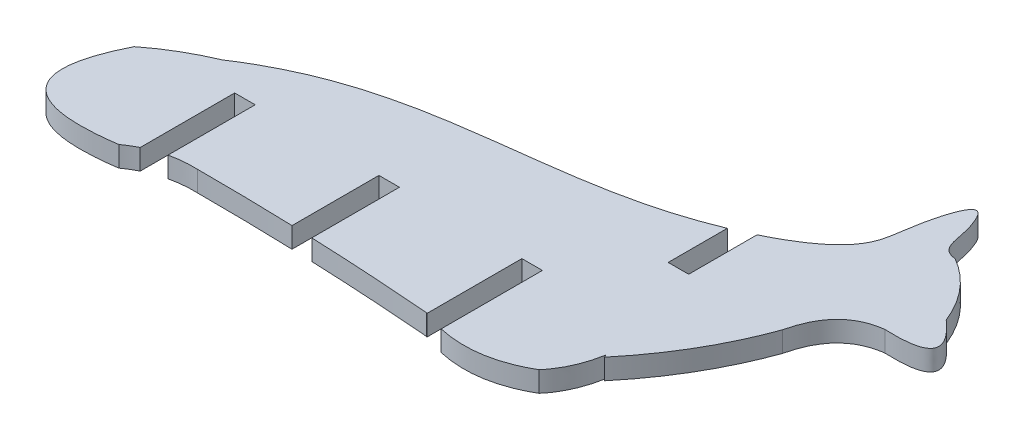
SolidWorks part; units mm, degrees
ref_plane "Alzado" through (0, 0, 0) normal (0, 0, 1) x (1, 0, 0)
ref_plane "Planta" through (0, 0, 0) normal (0, 1, 0) x (1, 0, 0)
ref_plane "Vista lateral" through (0, 0, 0) normal (1, 0, 0) x (0, 0, -1)
sketch "Croquis2" plane through (0, 0, 0) normal (0, 1, 0) x (1, 0, 0)
  line L0 (-20.4658, 19.6564) -> (39.7066, 19.6564) construction
  line L1 (55.0566, 13.5654) -> (55.2406, 13.232)
  line L19 (-5.2934, 19.6437) -> (-2.2934, 19.6437)
  line L20 (-5.2934, 19.6437) -> (-5.2934, 5.8226)
  line L22 (-2.2934, 19.6437) -> (-2.2934, 6.8949)
  line L24 (15.7066, 19.7494) -> (18.7066, 19.7494)
  line L25 (15.7066, 19.7494) -> (15.7066, 7.0318)
  line L27 (18.7066, 19.7494) -> (18.7066, 6.9231)
  line L28 (36.7066, 19.6674) -> (39.7066, 19.6674)
  line L29 (36.7066, 19.6674) -> (36.7066, 5.7706)
  line L31 (39.7066, 19.6674) -> (39.7066, 4.85)
  line L32 (50.8938, 39.8804) -> (50.8938, 29.8804)
  line L33 (50.8938, 29.8804) -> (47.8938, 29.8804)
  line L34 (47.8938, 38.5314) -> (47.8938, 29.8804)
  spline S0 degree 3 poles (47.8938, 38.5314) (28.0082, 30.2806) (8.6356, 35.4977) (-10.3742, 22.9361) knots 0.375874 0.375874 0.375874 0.375874 1 1 1 1
  spline S3 degree 3 poles (-5.2934, 5.8226) (-5.9644, 5.4879) (-6.6112, 5.0949) (-7.2337, 4.6437) knots 0.757247 0.757247 0.757247 0.757247 1 1 1 1
  spline S4 degree 3 poles (36.5574, 5.8293) (30.6107, 6.3212) (24.6604, 6.6858) (18.7066, 6.9231) knots 0.259121 0.259121 0.259121 0.259121 0.638689 0.638689 0.638689 0.638689
  spline S6 degree 2 poles (1.6945, 7.2544) (-0.4049, 7.3278) (-2.2934, 6.8949) knots 0 0 0 0.413123 0.413123 0.413123
  spline S7 degree 2 poles (-18.5169, 18.1508) (-26.7523, 1.7708) (-7.2337, 4.6437) knots 0 0 0 1 1 1
  spline S8 degree 2 poles (36.5574, 5.8293) (36.632, 5.7996) (36.7066, 5.7706) knots 0 0 0 0.009141 0.009141 0.009141
  spline S9 degree 3 poles (-18.5169, 18.1508) (-16.0294, 20.1252) (-13.2797, 21.6905) (-10.3742, 22.9361) knots 0.333246 0.333246 0.333246 0.333246 0.571138 0.571138 0.571138 0.571138
  spline S12 degree 2 poles (55.0566, 13.5654) (54.3373, 9.5112) (52.0237, 6.8354) knots 0 0 0 0.509779 0.509779 0.509779
  spline S13 degree 3 poles (15.7066, 7.0318) (11.0381, 7.1843) (6.3674, 7.2585) (1.6945, 7.2544) knots 0.702434 0.702434 0.702434 0.702434 1 1 1 1
  spline S14 degree 3 poles (39.7066, 4.85) (44, 3.8925) (48.1057, 4.5544) (52.0237, 6.8354) knots 0.194812 0.194812 0.194812 0.194812 1 1 1 1
  spline S15 degree 2 poles (55.2406, 13.232) (61.5806, 20.7999) (64.7882, 29.7016) knots 0 0 0 0.729811 0.729811 0.729811
  spline S16 degree 2 poles (64.7882, 29.7016) (66.3459, 36.5102) (72.2314, 37.2479) knots 0 0 0 1 1 1
  spline S17 degree 2 poles (72.2314, 37.2479) (82.4737, 36.7986) (75.5268, 42.9268) knots 0 0 0 1 1 1
  spline S18 degree 2 poles (75.5268, 42.9268) (73.2926, 48.5011) (68.4032, 51.3525) knots 0 0 0 1 1 1
  spline S19 degree 3 poles (68.4032, 51.3525) (66.1249, 51.5599) (66.2583, 54.7213) (63.6003, 61.4372) (61.0062, 52.7224) (60.8775, 45.6142) (54.8907, 41.8215) (50.8938, 39.8804) knots 0 0 0 0 0.056297 0.095033 0.158096 0.219407 0.344529 0.344529 0.344529 0.344529
  dimension "D1" = 18
  dimension "D2" = 18
  dimension "D4" = 3
extrude "Saliente-Extruir1" add sketch "Croquis2" along normal blind 3 contours S0 S9 S7 S3 L20 L19 L22 S6 S13 L25 L24 L27 S4 S8 L29 L28 L31 S14 S12 L1 S15 S16 S17 S18 S19 L32 L33 L34
